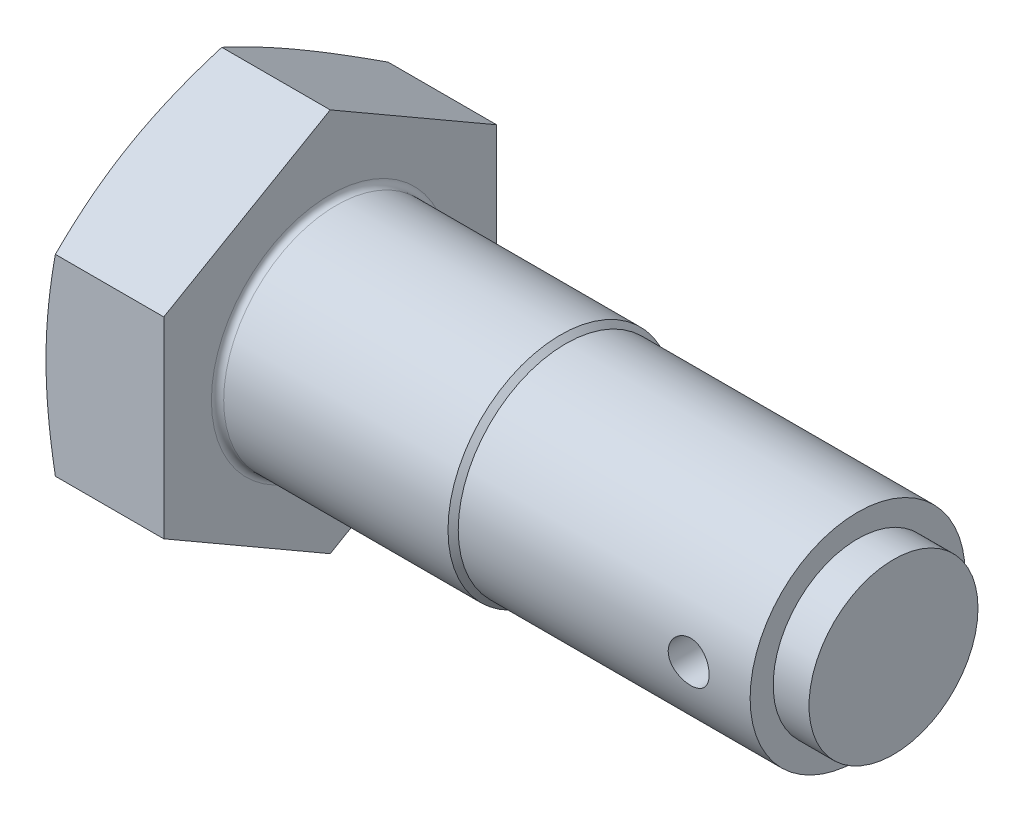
SolidWorks part; units mm, degrees
ref_plane "Front" through (0, 0, 0) normal (0, 0, 1) x (1, 0, 0)
ref_plane "Top" through (0, 0, 0) normal (0, 1, 0) x (1, 0, 0)
ref_plane "Right" through (0, 0, 0) normal (1, 0, 0) x (0, 0, -1)
sketch "Sketch1" plane through (0, 0, 0) normal (1, 0, 0) x (0, 0, -1)
  line L1 (0, -37.5278) -> (32.5, -18.7639)
  line L2 (32.5, -18.7639) -> (32.5, 18.7639)
  line L3 (32.5, 18.7639) -> (0, 37.5278)
  line L4 (0, 37.5278) -> (-32.5, 18.7639)
  line L5 (-32.5, 18.7639) -> (-32.5, -18.7639)
  line L6 (-32.5, -18.7639) -> (0, -37.5278)
  circle A0 centre (0, 0) radius 32.5 construction
  dimension "s" = 65
extrude "BaseHead" add sketch "Sketch1" along normal blind 23
sketch "Sketch2" plane through (23, 0, 0) normal (1, 0, 0) x (0, 0, -1)
  circle A0 centre (0, 0) radius 22
  dimension "ds" = 44
extrude "Basebody1" add sketch "Sketch2" along normal blind 45
sketch "Sketch4" plane through (68, 0, 0) normal (1, 0, 0) x (0, 0, -1)
  circle A0 centre (0, 0) radius 21
  dimension "d" = 42
extrude "Basebody2" add sketch "Sketch4" along normal offset from surface (65 mm away) 110
sketch "Sketch5" plane through (133, 0, 0) normal (1, 0, 0) x (0, 0, -1)
  circle A0 centre (0, 0) radius 16.5
  dimension "dp" = 33
extrude "Cut-Extrude1" cut sketch "Sketch5" against normal blind 7 flip side to cut
sketch "Sketch6" plane through (0, 0, 0) normal (0, 0, 1) x (1, 0, 0)
  line L0 (0, 37.5278) -> (1.83, 37.5278)
  line L1 (1.83, 37.5278) -> (0, 32.5)
  line L3 (0, 32.5) -> (0, 37.5278)
  line L4 (-1.5773, 0) -> (3.1205, 0) construction
  line L6 (23, 37.5278) -> (0, 37.5278) construction
  dimension "D1" = 20
  dimension "D2" = 65
revolve "HeadChamfer" cut sketch "Sketch6" angle 360 about L4
fillet "HeadFillet" radius 1.2 1 edges at (23, 0, -22)
chamfer "Chamfer1" distance 1 angle 45 1 edges at (68, 0, -21)
sketch "Sketch7" plane through (0, 0, 0) normal (0, 0, 1) x (1, 0, 0)
  line L1 (23, 37.5278) -> (23, 18.7639) construction
  line L4 (126, 0) -> (69, 0) construction
  circle A0 centre (114, 0) radius 4
  dimension "d1" = 8
  dimension "lh" = 91
extrude "Hole" cut sketch "Sketch7" against normal through all and the other way through all
equation "\"D1@Chamfer1\" =  ( \"ds@Sketch2\" - \"d@Sketch4\" )  / 2"
equation "\"D2@Sketch6\" = \"s@Sketch1\""
